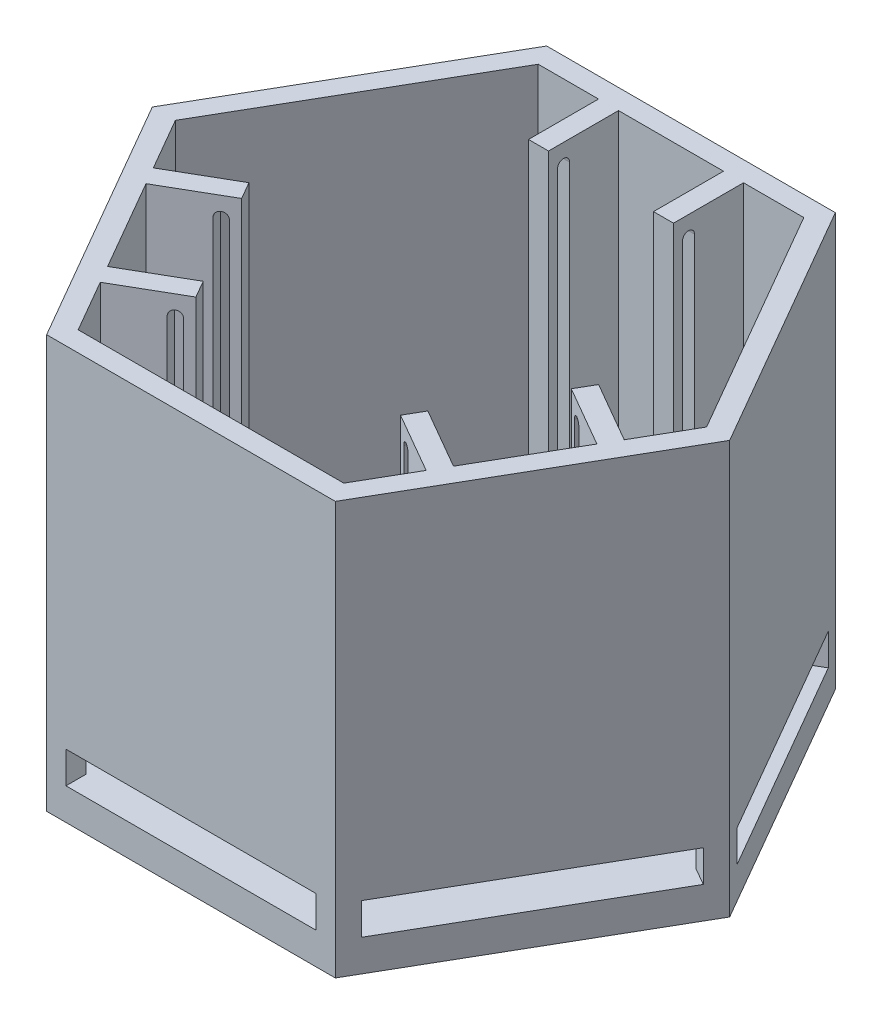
SolidWorks part; units mm, degrees
ref_plane "Front Plane" through (0, 0, 0) normal (0, 0, 1) x (1, 0, 0)
ref_plane "Top Plane" through (0, 0, 0) normal (0, 1, 0) x (1, 0, 0)
ref_plane "Right Plane" through (0, 0, 0) normal (1, 0, 0) x (0, 0, -1)
sketch "Sketch1" plane through (0, 0, 0) normal (0, 1, 0) x (1, 0, 0)
  line L1 (28.8675, 0) -> (14.4338, 25)
  line L2 (14.4338, 25) -> (-14.4338, 25)
  line L3 (-14.4338, 25) -> (-28.8675, 0)
  line L4 (-28.8675, 0) -> (-14.4338, -25)
  line L5 (-14.4338, -25) -> (14.4338, -25)
  line L6 (14.4338, -25) -> (28.8675, 0)
  line L9 (21.6506, -12.5) -> (0, 25) construction
  line L10 (21.6506, -12.5) -> (0, 0) construction
  line L11 (0, 0) -> (0, 25) construction
  circle A0 centre (0, 0) radius 25 construction
  point P10 (0, 0)
  dimension "D1" = 50
extrude "Boss-Extrude1" add sketch "Sketch1" along normal blind 3.175
sketch "Sketch2" plane through (0, 3.175, 0) normal (0, 1, 0) x (1, 0, 0)
  line L12 (13.2791, -23) -> (26.5581, 0)
  line L13 (26.5581, 0) -> (13.2791, 23)
  line L14 (13.2791, 23) -> (-13.2791, 23)
  line L15 (-13.2791, 23) -> (-26.5581, 0)
  line L16 (-26.5581, 0) -> (-13.2791, -23)
  line L17 (-13.2791, -23) -> (13.2791, -23)
  line L18 (13.2791, -23) -> (26.5581, 0)
  line L19 (26.5581, 0) -> (13.2791, 23)
  line L20 (13.2791, 23) -> (-13.2791, 23)
  line L21 (-13.2791, 23) -> (-26.5581, 0)
  line L22 (-26.5581, 0) -> (-13.2791, -23)
  line L23 (-13.2791, -23) -> (13.2791, -23)
  line L25 (14.4338, -25) -> (28.8675, 0)
  line L26 (28.8675, 0) -> (14.4338, 25)
  line L27 (14.4338, 25) -> (-14.4338, 25)
  line L28 (-14.4338, 25) -> (-28.8675, 0)
  line L29 (-28.8675, 0) -> (-14.4338, -25)
  line L30 (-14.4338, -25) -> (14.4338, -25)
  line L31 (14.4338, -25) -> (28.8675, 0)
  line L32 (28.8675, 0) -> (14.4338, 25)
  line L33 (14.4338, 25) -> (-14.4338, 25)
  line L34 (-14.4338, 25) -> (-28.8675, 0)
  line L35 (-28.8675, 0) -> (-14.4338, -25)
  line L36 (-14.4338, -25) -> (14.4338, -25)
  dimension "D1" = 2
  dimension "D2" = 0
extrude "Boss-Extrude2" add sketch "Sketch2" along normal blind 38.1
sketch "Sketch3" plane through (21.6506, 0, 12.5) normal (0.866, 0, 0.5) x (0.5, 0, -0.866)
  line L0 (-13.2791, 3.175) -> (13.2791, 3.175) construction
  line L1 (-12.5, 3.175) -> (12.5, 3.175)
  line L2 (-12.5, 3.175) -> (-12.5, 6.35)
  line L3 (-12.5, 6.35) -> (12.5, 6.35)
  line L4 (12.5, 3.175) -> (12.5, 6.35)
  line L5 (-14.4338, 0) -> (14.4338, 0) construction
  point P6 (0, 0)
  point P12 (0, 6.35)
  dimension "D1" = 25
  dimension "D2" = 3.175
extrude "Cut-Extrude1" cut sketch "Sketch3" against normal blind 84.074
sketch "Sketch4" plane through (0, 41.275, 0) normal (0, 1, 0) x (1, 0, 0)
  line L0 (23.5436, -5.2213) -> (17.4814, -1.7213)
  line L1 (13.2791, -23) -> (26.5581, 0) construction
  line L2 (17.4814, -1.7213) -> (16.4814, -3.4534)
  line L3 (16.4814, -3.4534) -> (22.5436, -6.9534)
  line L4 (17.2936, -16.0466) -> (11.2314, -12.5466)
  line L5 (11.2314, -12.5466) -> (10.2314, -14.2787)
  line L6 (10.2314, -14.2787) -> (16.2936, -17.7787)
  line L7 (20.5125, -3.4713) -> (13.2625, -16.0287) construction
  line L8 (19.9186, -11.5) -> (16.8875, -9.75) construction
  line L9 (23.5436, -5.2213) -> (22.5436, -6.9534)
  line L10 (17.2936, -16.0466) -> (16.2936, -17.7787)
  point P12 (19.9186, -11.5)
  dimension "D1" = 10.5
  dimension "D2" = 7
  dimension "D3" = 2
extrude "Boss-Extrude3" add sketch "Sketch4" against normal blind 30
sketch "Sketch5" plane through (3.625, 0, -6.2787) normal (0.5, 0, -0.866) x (-0.866, 0, -0.5)
  line L0 (-17.5, 39.275) -> (-17.5, 13.275) construction
  line L1 (-16.9, 39.275) -> (-16.9, 13.275)
  line L2 (-18.1, 39.275) -> (-18.1, 13.275)
  line L3 (-16, 11.275) -> (-16, 41.275) construction
  line L4 (-23, 11.275) -> (-16, 11.275) construction
  line L5 (-25, 41.275) -> (0, 41.275) construction
  arc A0 (-16.9, 39.275) -> (-18.1, 39.275) centre (-17.5, 39.275) ccw
  arc A1 (-18.1, 13.275) -> (-16.9, 13.275) centre (-17.5, 13.275) ccw
  point P2 (-17.5, 26.275)
  point P9 (-17.5, 42.0144)
  point P12 (-17.5, 40.4179)
  dimension "D1" = 0.6
  dimension "D2" = 1.5
  dimension "D3" = 2
  dimension "D4" = 2
extrude "Cut-Extrude2" cut sketch "Sketch5" against normal blind 15 contours A0 L2 A1 L1
pattern_circular "CirPattern1" count 3 over 360 about axis through (0, 0, 0) along (0, 1, 0) of "Cut-Extrude1", "Boss-Extrude3", "Cut-Extrude2"
